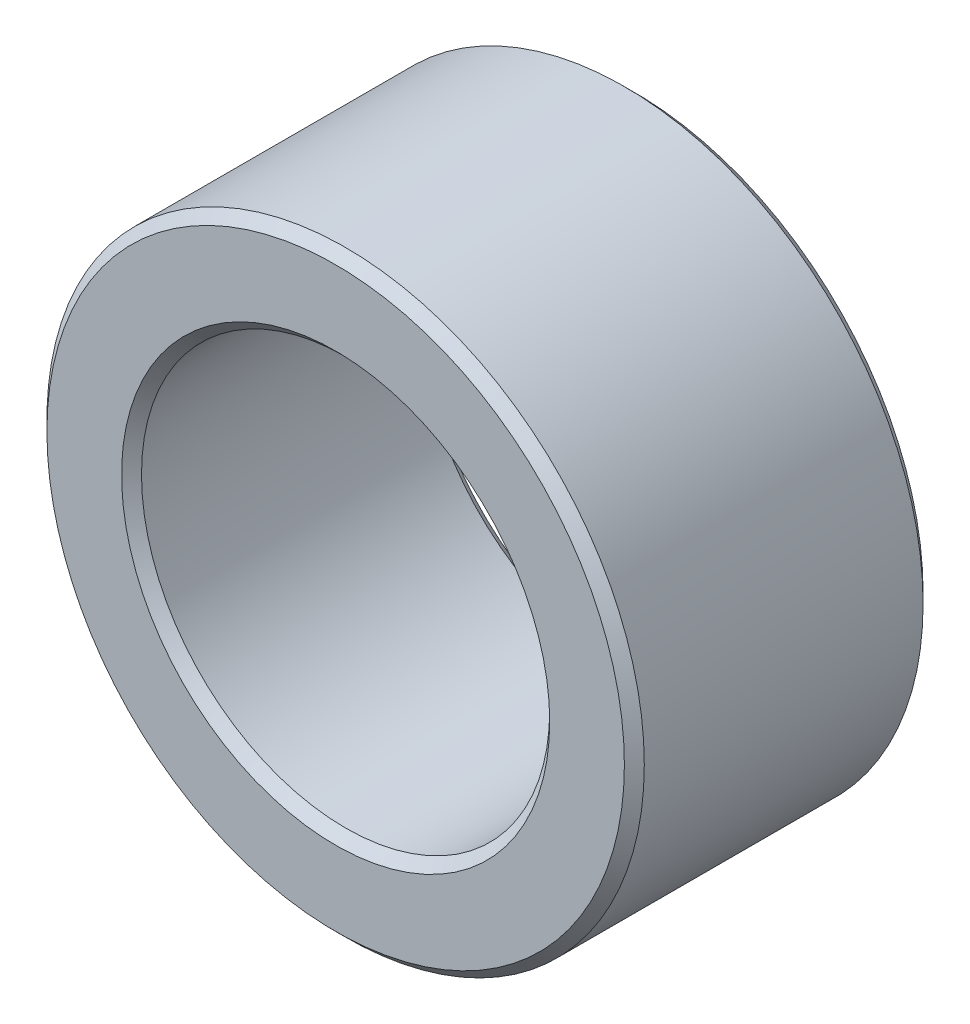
SolidWorks part; units mm, degrees
ref_plane "Front Plane" through (0, 0, 0) normal (0, 0, 1) x (1, 0, 0)
ref_plane "Top Plane" through (0, 0, 0) normal (0, 1, 0) x (1, 0, 0)
ref_plane "Right Plane" through (0, 0, 0) normal (1, 0, 0) x (0, 0, -1)
sketch "Sketch1" plane through (0, 0, 0) normal (0, 0, 1) x (1, 0, 0)
  circle A0 centre (0, 0) radius 6
  circle A1 centre (0, 0) radius 4.1
  dimension "D1" = 12
  dimension "D2" = 8.2
extrude "Boss-Extrude2" add sketch "Sketch1" along normal mid plane 6
chamfer "Chamfer3" distance 0.2 angle 45 4 edges at (6, 0, 3) (6, 0, -3) (4.1, 0, -3) (4.1, 0, 3)
